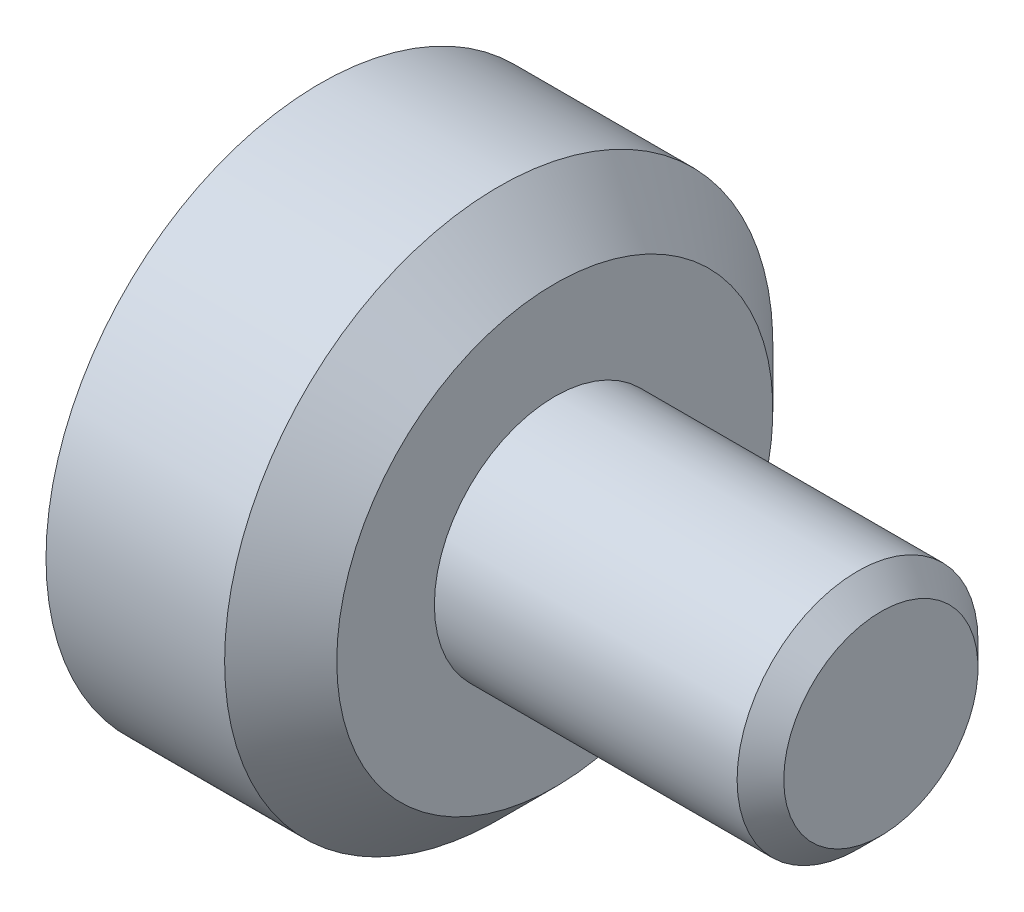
SolidWorks part; units mm, degrees
ref_plane "Plan de face" through (0, 0, 0) normal (0, 0, 1) x (1, 0, 0)
ref_plane "Plan de dessus" through (0, 0, 0) normal (0, 1, 0) x (1, 0, 0)
ref_plane "Plan de droite" through (0, 0, 0) normal (1, 0, 0) x (0, 0, -1)
sketch "Esquisse1" plane through (0, 0, 0) normal (0, 0, 1) x (1, 0, 0)
  line L0 (-54.462, 0) -> (88.7793, 0) construction
  line L1 (-42.0063, 0) -> (-42.0063, 58.7201)
  line L2 (-42.0063, 58.7201) -> (-3.7492, 58.7201)
  line L3 (-3.7492, 58.7201) -> (8.2617, 46.7091)
  line L4 (8.2617, 46.7091) -> (8.2617, 25.8012)
  line L5 (8.2617, 25.8012) -> (78.103, 25.8012)
  line L6 (78.103, 25.8012) -> (78.103, 0)
  line L7 (-42.0063, 0) -> (78.103, 0)
revolve "Révolution1" add sketch "Esquisse1" angle 360 about L0
chamfer "Chanfrein1" distance 5 angle 45 1 edges at (78.103, 0, 25.8012)
